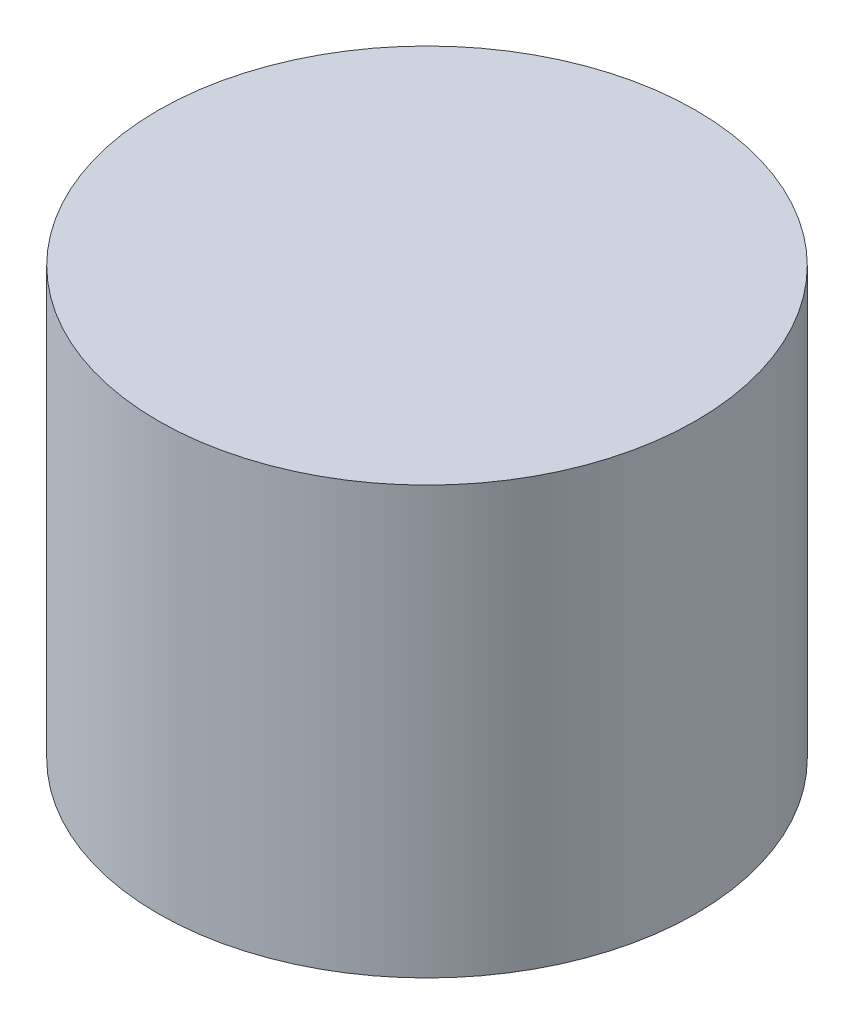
SolidWorks part; units mm, degrees
ref_plane "Ebene vorne" through (0, 0, 0) normal (0, 0, 1) x (1, 0, 0)
ref_plane "Ebene oben" through (0, 0, 0) normal (0, 1, 0) x (1, 0, 0)
ref_plane "Ebene rechts" through (0, 0, 0) normal (1, 0, 0) x (0, 0, -1)
sketch "Skizze8" plane through (0, 0, 0) normal (0, 1, 0) x (1, 0, 0)
  circle A0 centre (0, 0) radius 315
  dimension "D1" = 630
extrude "Linear austragen4" add sketch "Skizze8" along normal mid plane 500
